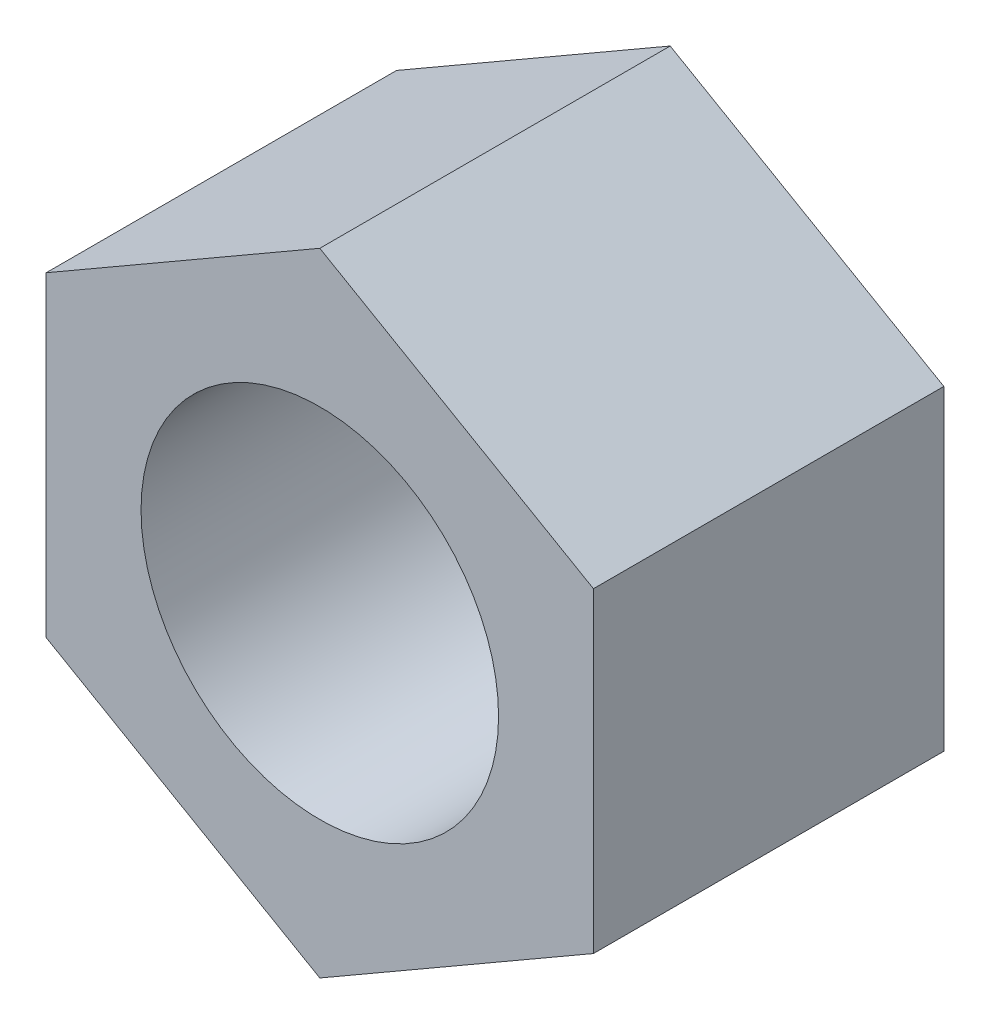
SolidWorks part; units mm, degrees
ref_plane "Front Plane" through (0, 0, 0) normal (1, 0, 0) x (0, 1, 0)
ref_plane "Top Plane" through (0, 0, 0) normal (0, 0, 1) x (0, 1, 0)
ref_plane "Right Plane" through (0, 0, 0) normal (0, 1, 0) x (-1, 0, 0)
sketch "Sketch1" plane through (0, 0, 0) normal (0, 0, 1) x (0, 1, 0)
  line L1 (25.2526, -43.7388) -> (50.5052, 0)
  line L2 (50.5052, 0) -> (25.2526, 43.7388)
  line L3 (25.2526, 43.7388) -> (-25.2526, 43.7388)
  line L4 (-25.2526, 43.7388) -> (-50.5052, 0)
  line L5 (-50.5052, 0) -> (-25.2526, -43.7388)
  line L6 (-25.2526, -43.7388) -> (25.2526, -43.7388)
  circle A0 centre (0, 0) radius 28.575
  circle A1 centre (0, 0) radius 43.7388 construction
  dimension "D1" = 57.15
  dimension "D2" = 87.4776
extrude "Nut body" add sketch "Sketch1" along normal blind 56.007
